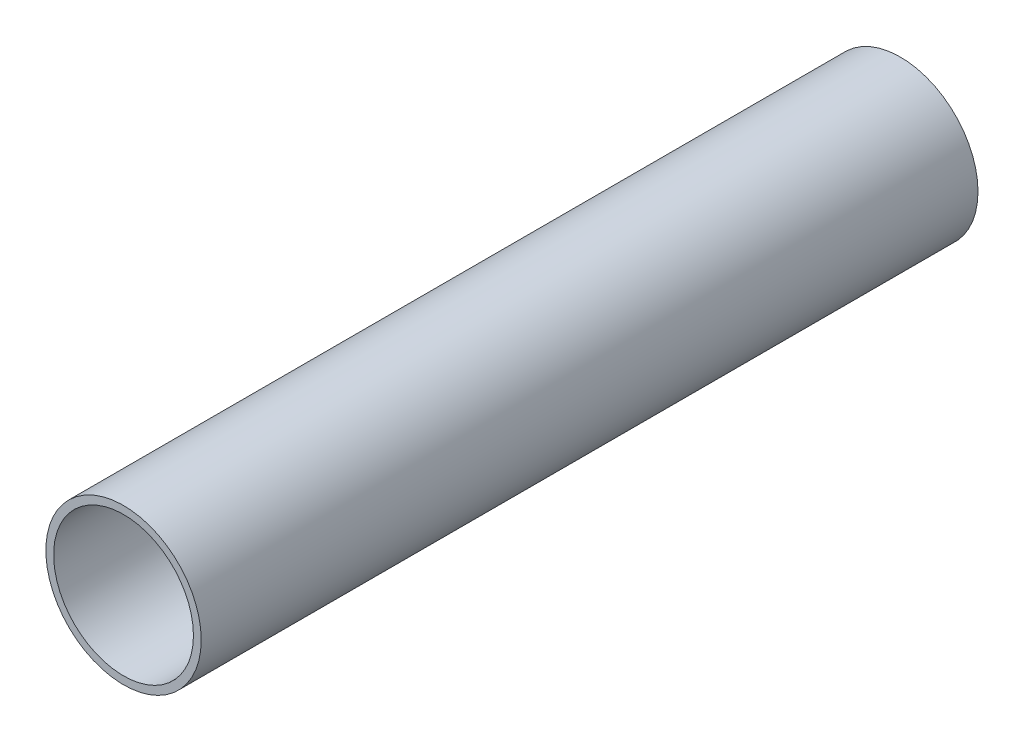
SolidWorks part; units mm, degrees
ref_plane "Plan de face" through (0, 0, 0) normal (0, 0, 1) x (1, 0, 0)
ref_plane "Plan de dessus" through (0, 0, 0) normal (0, 1, 0) x (1, 0, 0)
ref_plane "Plan de droite" through (0, 0, 0) normal (1, 0, 0) x (0, 0, -1)
sketch "Esquisse1" plane through (0, 0, 0) normal (0, 0, 1) x (1, 0, 0)
  line L0 (0, 24.9373) -> (0, -24.9373) construction
  line L1 (-33.3744, 0) -> (23.8642, 0) construction
  circle A0 centre (0, 0) radius 15
  dimension "D1" = 30
extrude "Extru.-Mince1" add sketch "Esquisse1" along normal blind 150 thin
